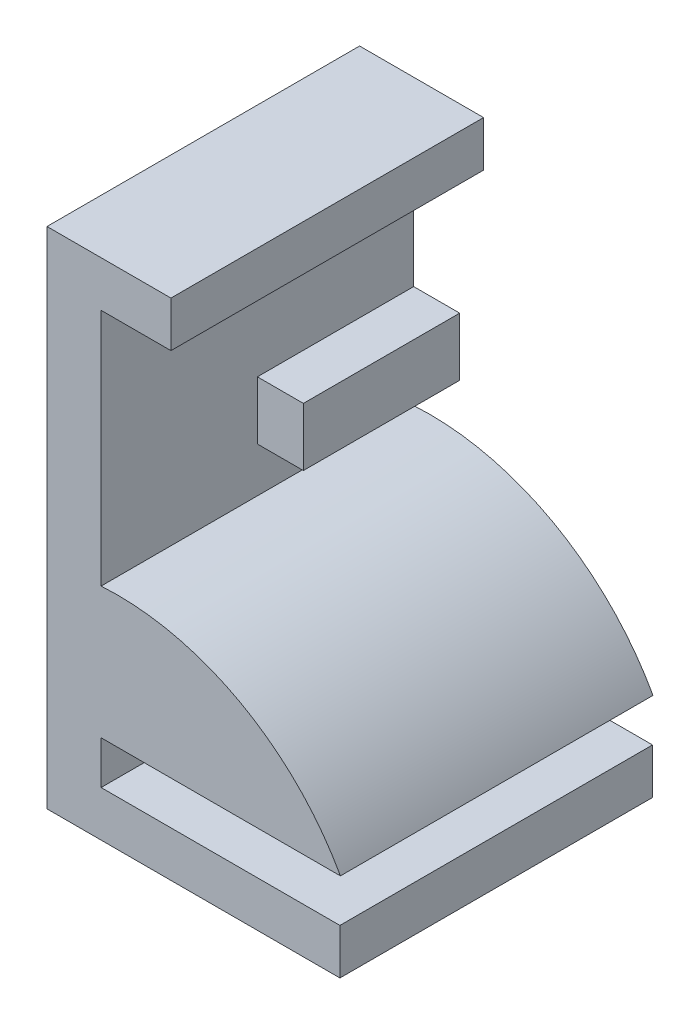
SolidWorks part; units mm, degrees
ref_plane "Front" through (0, 0, 0) normal (0, 0, 1) x (1, 0, 0)
ref_plane "Top" through (0, 0, 0) normal (0, 1, 0) x (1, 0, 0)
ref_plane "Right" through (0, 0, 0) normal (1, 0, 0) x (0, 0, -1)
sketch "Sketch1" plane through (8.5643, -28.3878, 0) normal (0, 0, 1) x (0, 1, 0)
  line L0 (-58.1634, -54.4213) -> (95.1155, -54.4213)
  line L4 (95.1155, -54.4213) -> (95.1155, -92.0903)
  line L6 (-58.1634, -143.4403) -> (-58.1634, -54.4213)
  line L16 (-131.7247, -54.4213) -> (174.6253, -54.4213) construction
  line L17 (8.6933, -70.8632) -> (22.3345, -70.8632)
  line L18 (40.0175, -70.8632) -> (81.2746, -70.8632)
  line L19 (40.0175, -84.8357) -> (40.0175, -70.8632)
  line L20 (22.3345, -84.8357) -> (40.0175, -84.8357)
  line L21 (22.3345, -70.8632) -> (22.3345, -84.8357)
  line L24 (-31.2198, -70.8632) -> (-31.2198, -143.5861)
  line L25 (-58.1634, -143.4403) -> (-44.3225, -143.4403)
  line L26 (81.2746, -92.0903) -> (95.1155, -92.0903)
  line L27 (81.2746, -70.8632) -> (81.2746, -92.0903)
  line L28 (-44.3225, -70.8632) -> (-31.2198, -70.8632)
  line L29 (-44.3225, -143.4403) -> (-44.3225, -70.8632)
  arc A0 (8.6933, -70.8632) -> (-31.2198, -143.5861) centre (-68.5772, -75.7686) cw
extrude "Extrude1" add sketch "Sketch1" along normal mid plane 95
ref_plane "Plane1" through (0, 76.7276, 0) normal (0, 1, 0) x (-1, 0, 0)
sketch "Sketch3" plane through (0, 11.6297, 0) normal (0, 1, 0) x (-1, 0, 0)
  line L0 (-79.4274, 0) -> (-93.3999, 0)
  line L4 (-93.3999, -47.5) -> (-79.4274, -47.5)
  line L5 (-79.4274, -47.5) -> (-79.4274, 47.5)
  line L6 (-79.4274, 47.5) -> (-93.3999, 47.5)
  line L7 (-93.3999, 47.5) -> (-93.3999, -47.5)
  line L9 (-79.4274, 0) -> (-79.4274, 47.5)
  line L10 (-79.4274, 47.5) -> (-93.3999, 47.5)
  line L11 (-93.3999, 47.5) -> (-93.3999, 0)
  dimension "D1" = 0
extrude "Cut-Extrude1" cut sketch "Sketch3" against normal up to next
sketch "Sketch2" plane through (0, 76.7276, 0) normal (0, 1, 0) x (-1, 0, 0)
  circle A0 centre (-118.9971, 0) radius 15.9977
